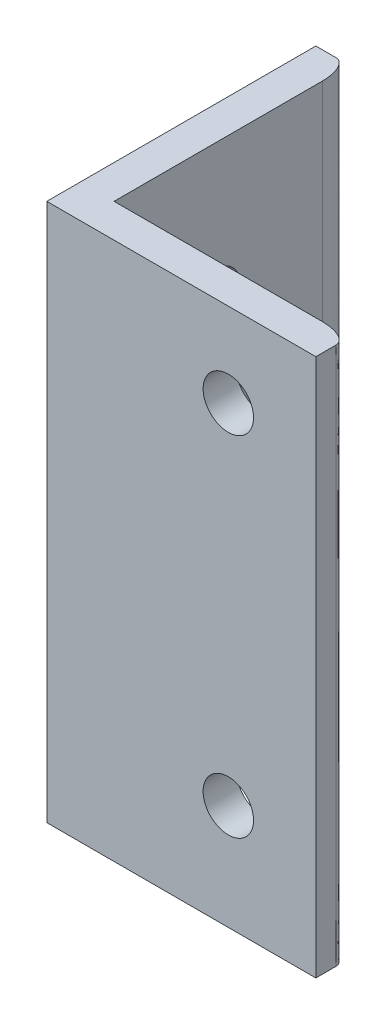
SolidWorks part; units mm, degrees
ref_plane "Front Plane" through (0, 0, 0) normal (0, 0, 1) x (1, 0, 0)
ref_plane "Top Plane" through (0, 0, 0) normal (0, 1, 0) x (1, 0, 0)
ref_plane "Right Plane" through (0, 0, 0) normal (1, 0, 0) x (0, 0, -1)
sketch "Sketch1" plane through (0, 0, 0) normal (0, 1, 0) x (1, 0, 0)
  line L0 (0, 0) -> (0, -25.4)
  line L1 (0, -25.4) -> (25.4, -25.4)
  line L2 (0, 0) -> (3.175, 0)
  line L3 (3.175, 0) -> (3.175, -22.225)
  line L4 (3.175, -22.225) -> (25.4, -22.225)
  line L5 (25.4, -22.225) -> (25.4, -25.4)
  dimension "D1" = 25.4
  dimension "D2" = 25.4
  dimension "D3" = 3.175
  dimension "D4" = 3.175
extrude "Boss-Extrude1" add sketch "Sketch1" along normal blind 50.8
fillet "Fillet1" radius 2.54 1 edges at (3.175, 25.4, 0)
fillet "Fillet2" radius 1.27 1 edges at (25.4, 25.4, 22.225)
sketch "Sketch2" plane through (0, 0, 22.225) normal (0, 0, -1) x (-1, 0, 0)
  line L0 (-25.4, 50.8) -> (-25.4, 0) construction
  line L1 (-22.86, 50.8) -> (-3.175, 50.8) construction
  circle A0 centre (-17.1374, 42.8625) radius 2.3812
  circle A1 centre (-17.1374, 9.9466) radius 2.3813
  circle A2 centre (-17.1374, -22.9692) radius 2.3813
  circle A3 centre (-17.1374, -55.8851) radius 2.3812
  circle A4 centre (-17.1374, -88.8009) radius 2.3812
  circle A5 centre (-17.1374, -121.7168) radius 2.3812
  dimension "D1" = 4.7625
  dimension "D2" = 8.2626
  dimension "D3" = 7.9375
  dimension "D5" = 32.9159
  dimension "D4" = 6
extrude "Cut-Extrude1" cut sketch "Sketch2" against normal blind 3.175
sketch "Sketch3" plane through (3.175, 0, 0) normal (1, 0, 0) x (0, 0, -1)
  line L0 (0, 50.8) -> (0, 0) construction
  line L2 (-22.225, 50.8) -> (-2.54, 50.8) construction
  circle A0 centre (-12.7, 38.1) radius 2.3812
  circle A1 centre (-12.7, 12.7) radius 2.3813
  circle A2 centre (-12.7, -12.7) radius 2.3813
  circle A3 centre (-12.7, -38.1) radius 2.3812
  circle A4 centre (-12.7, -63.5) radius 2.3812
  circle A5 centre (-12.7, -88.9) radius 2.3812
  dimension "D1" = 4.7625
  dimension "D2" = 12.7
  dimension "D3" = 12.7
  dimension "D5" = 25.4
  dimension "D4" = 6
extrude "Cut-Extrude2" cut sketch "Sketch3" against normal blind 3.175
